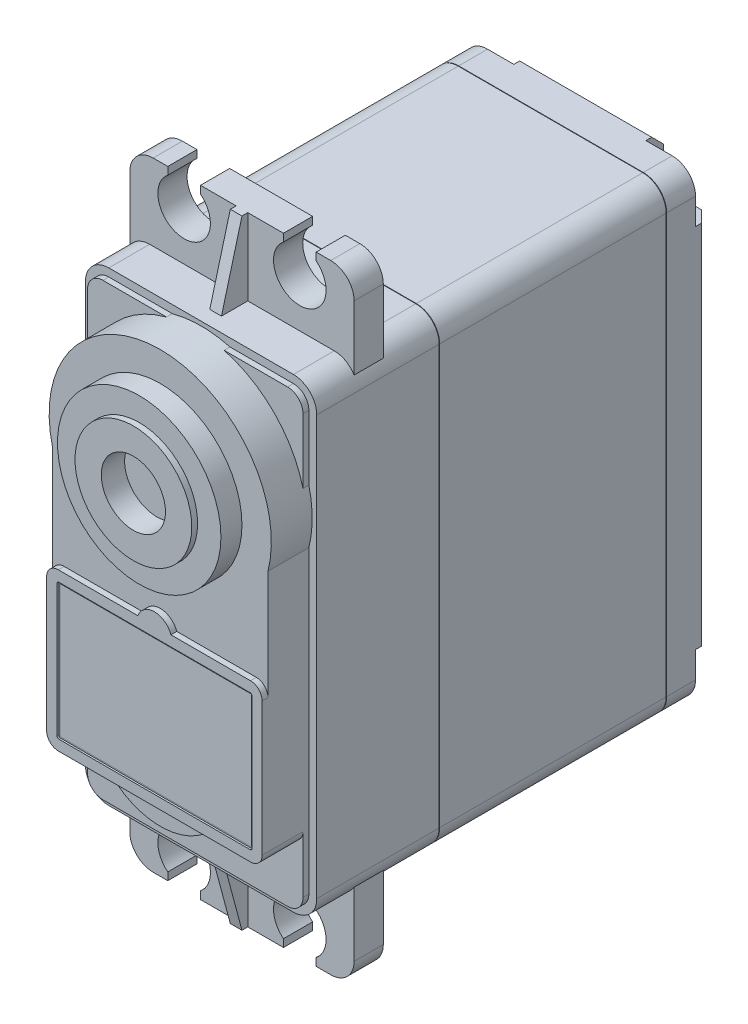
SolidWorks part; units mm, degrees
ref_plane "Piano frontale" through (0, 0, 0) normal (0, 0, 1) x (1, 0, 0)
ref_plane "Piano superiore" through (0, 0, 0) normal (0, 1, 0) x (1, 0, 0)
ref_plane "Piano destro" through (0, 0, 0) normal (1, 0, 0) x (0, 0, -1)
sketch "RIFERIMENTO" plane through (0, 0, 0) normal (0, 0, 1) x (1, 0, 0)
  line L0 (27.4785, 59.5052) -> (56.14, 59.5052) construction
  line L1 (31.8933, 83.5052) -> (51.7033, 83.5052) construction
  line L2 (31.8933, 35.5052) -> (51.7033, 35.5052) construction
  line L3 (41.7983, 33.0902) -> (41.7983, 85.9202) construction
  line L4 (46.7513, 33.0902) -> (46.7513, 85.9202) construction
  line L5 (36.8453, 33.0902) -> (36.8453, 85.9202) construction
  line L6 (35.4453, 33.0902) -> (35.4453, 33.7438)
  line L7 (38.2453, 33.0902) -> (38.2453, 33.7438)
  line L8 (45.3513, 33.0902) -> (45.3513, 33.7438)
  line L9 (48.1513, 33.0902) -> (48.1513, 33.7438)
  line L10 (38.2453, 33.0902) -> (45.3513, 33.0902)
  line L11 (35.4453, 85.9202) -> (35.4453, 85.2666)
  line L12 (38.2453, 85.9202) -> (38.2453, 85.2666)
  line L13 (48.1513, 85.9202) -> (48.1513, 85.2666)
  line L14 (45.3513, 85.9202) -> (45.3513, 85.2666)
  line L15 (35.4453, 85.9202) -> (34.1933, 85.9202)
  line L16 (32.1933, 83.9202) -> (32.1933, 78.4238)
  line L17 (45.3513, 85.9202) -> (38.2453, 85.9202)
  line L18 (28.408, 69.5052) -> (54.9221, 69.5052) construction
  line L19 (33.9696, 46.7742) -> (33.9696, 57.4156)
  line L20 (49.6489, 46.7742) -> (49.6489, 57.4156)
  line L21 (33.9696, 57.4156) -> (49.6489, 57.4156)
  line L22 (33.9696, 46.7742) -> (49.6489, 46.7742)
  line L23 (51.4033, 78.4238) -> (51.4033, 83.9202)
  line L24 (49.4033, 85.9202) -> (48.1513, 85.9202)
  line L25 (35.4453, 33.0902) -> (34.1933, 33.0902)
  line L26 (32.1933, 35.0902) -> (32.1933, 40.4366)
  line L27 (51.4033, 40.4366) -> (51.4033, 35.0902)
  line L28 (49.4033, 33.0902) -> (48.1513, 33.0902)
  line L29 (32.5696, 46.3742) -> (32.5696, 57.8156)
  line L30 (33.5696, 58.8156) -> (40.384, 58.8156)
  line L31 (33.5696, 45.3742) -> (50.0489, 45.3742)
  line L32 (42.3983, 69.2052) -> (42.6983, 69.2052)
  line L33 (42.8483, 69.3552) -> (42.8483, 69.6552)
  line L34 (42.6983, 69.8052) -> (42.3983, 69.8052)
  line L35 (42.0983, 70.1052) -> (42.0983, 70.4052)
  line L36 (41.9483, 70.5552) -> (41.6483, 70.5552)
  line L37 (41.4983, 70.4052) -> (41.4983, 70.1052)
  line L38 (41.1983, 69.8052) -> (40.8983, 69.8052)
  line L39 (40.7483, 69.6552) -> (40.7483, 69.3552)
  line L40 (40.8983, 69.2052) -> (41.1983, 69.2052)
  line L41 (41.4983, 68.9052) -> (41.4983, 68.6052)
  line L42 (41.6483, 68.4552) -> (41.9483, 68.4552)
  line L43 (42.0983, 68.6052) -> (42.0983, 68.9052)
  line L44 (31.8933, 77.3702) -> (31.8933, 41.4902)
  line L45 (33.8933, 39.4902) -> (49.7033, 39.4902)
  line L46 (51.7033, 41.4902) -> (51.7033, 77.3702)
  line L47 (49.7033, 79.3702) -> (33.8933, 79.3702)
  line L48 (32.5696, 77.3702) -> (32.5696, 41.4902)
  line L49 (33.8933, 40.1665) -> (49.7033, 40.1665)
  line L50 (51.027, 41.4902) -> (51.027, 77.3702)
  line L51 (49.7033, 78.6939) -> (33.8933, 78.6939)
  line L52 (51.027, 46.3742) -> (51.027, 57.8156)
  line L53 (42.2983, 33.0902) -> (42.2983, 39.4902)
  line L54 (41.2983, 33.0902) -> (41.2983, 39.4902)
  line L55 (42.2983, 81.4885) -> (42.2983, 85.9202)
  line L56 (41.2983, 81.4996) -> (41.2983, 85.9202)
  line L57 (70.4217, 57.5059) -> (70.4217, 81.4996)
  line L58 (70.4217, 81.4996) -> (72.4217, 81.4996)
  line L59 (72.4217, 81.4996) -> (72.4217, 57.5059)
  line L60 (72.4217, 57.5059) -> (70.4217, 57.5059)
  line L61 (76.9317, 45.3742) -> (76.9317, 58.8156)
  line L62 (76.9317, 58.8156) -> (77.4317, 58.8156)
  line L63 (80.9317, 39.4902) -> (80.9317, 79.3702)
  line L64 (113.8717, 39.4902) -> (80.9317, 39.4902)
  line L65 (91.4317, 39.4902) -> (91.4317, 79.3702)
  line L66 (80.9317, 79.3702) -> (113.8717, 79.3702)
  line L67 (114.8717, 78.3702) -> (114.8717, 40.4902)
  line L68 (86.9317, 39.4902) -> (86.9317, 33.0902)
  line L69 (86.9317, 33.0902) -> (84.4317, 33.0902)
  line L70 (84.4317, 33.0902) -> (84.4317, 39.4902)
  line L71 (84.4317, 33.0902) -> (83.9317, 33.0902)
  line L72 (83.9317, 33.0902) -> (82.2168, 39.4902)
  line L73 (86.9317, 79.3702) -> (86.9317, 85.7702)
  line L74 (86.9317, 85.7702) -> (84.4317, 85.7702)
  line L75 (84.4317, 85.7702) -> (84.4317, 79.3702)
  line L76 (84.4317, 85.7702) -> (83.9317, 85.7702)
  line L77 (83.9317, 85.7702) -> (82.2168, 79.3702)
  line L78 (76.9317, 45.3742) -> (80.4317, 45.3742)
  line L79 (80.9317, 78.8702) -> (80.4317, 78.8702)
  line L80 (77.4317, 79.0202) -> (77.4317, 58.8156)
  line L81 (76.9317, 58.8156) -> (76.9317, 59.8156)
  line L82 (76.9317, 59.8156) -> (77.4317, 59.8156)
  line L83 (77.4317, 43.6525) -> (80.4317, 43.6525)
  line L84 (80.9317, 39.9902) -> (80.4317, 39.9902)
  line L85 (80.4317, 39.9902) -> (80.4317, 67.1884)
  line L86 (77.4317, 45.3742) -> (77.4317, 43.6525)
  line L87 (80.9317, 79.0202) -> (77.4317, 79.0202)
  line L88 (77.4317, 67.1884) -> (80.4317, 67.1884)
  line L89 (80.4317, 71.8219) -> (80.4317, 78.8702)
  line L90 (69.9217, 65.8051) -> (69.9217, 73.2003)
  line L91 (70.4217, 73.2003) -> (69.9217, 73.2003)
  line L92 (70.4217, 65.8051) -> (69.9217, 65.8051)
  line L93 (110.8717, 79.3702) -> (110.8717, 39.4902)
  line L94 (114.8717, 43.7402) -> (113.3717, 43.7402)
  line L95 (113.3717, 43.7402) -> (113.3717, 39.4902)
  line L96 (113.8717, 39.4902) -> (114.8717, 40.4902)
  line L97 (113.8717, 79.3702) -> (114.8717, 78.3702)
  line L98 (114.8717, 75.1202) -> (113.3717, 75.1202)
  line L99 (113.3717, 75.1202) -> (113.3717, 79.3702)
  line L100 (113.8717, 75.1202) -> (113.8717, 43.7402)
  line L101 (72.4217, 74.0027) -> (74.4217, 74.0027)
  line L102 (74.4217, 74.0027) -> (74.4217, 65.0027)
  line L103 (74.4217, 65.0027) -> (72.4217, 65.0027)
  line L104 (67.8152, 69.5052) -> (83.0318, 69.5052) construction
  line L105 (75.6317, 76.5052) -> (75.6317, 62.5052)
  line L106 (75.6317, 76.5052) -> (77.4317, 76.5052)
  line L107 (75.6317, 62.5052) -> (77.4317, 62.5052)
  line L108 (75.6317, 74.5052) -> (75.1317, 74.5052)
  line L109 (75.1317, 74.5052) -> (75.1317, 64.5052)
  line L110 (75.1317, 64.5052) -> (75.6317, 64.5052)
  line L111 (43.2125, 58.8156) -> (50.0489, 58.8156)
  arc A0 (48.1513, 33.7438) -> (45.3513, 33.7438) centre (46.7513, 35.5052) ccw
  arc A1 (38.2453, 33.7438) -> (35.4453, 33.7438) centre (36.8453, 35.5052) ccw
  arc A2 (35.4453, 85.2666) -> (38.2453, 85.2666) centre (36.8453, 83.5052) ccw
  arc A3 (45.3513, 85.2666) -> (48.1513, 85.2666) centre (46.7513, 83.5052) ccw
  circle A4 centre (41.6651, 69.5052) radius 12
  circle A5 centre (50.2983, 69.5052) radius 0.6
  circle A6 centre (49.7985, 72.3768) radius 0.6
  circle A7 centre (49.7985, 66.6335) radius 0.6
  circle A8 centre (33.2983, 69.5052) radius 0.6
  circle A9 centre (33.798, 72.3768) radius 0.6
  circle A10 centre (33.798, 66.6335) radius 0.6
  circle A11 centre (41.7983, 76.3052) radius 0.6
  circle A12 centre (41.7983, 79.5052) radius 0.6
  circle A13 centre (44.1459, 75.8871) radius 0.6
  circle A14 centre (45.2506, 78.8903) radius 0.6
  circle A15 centre (39.4507, 75.8871) radius 0.6
  circle A16 centre (38.3459, 78.8903) radius 0.6
  circle A17 centre (41.7983, 62.7052) radius 0.6
  circle A18 centre (41.7983, 59.5052) radius 0.6
  circle A19 centre (44.1459, 63.1233) radius 0.6
  circle A20 centre (45.2506, 60.12) radius 0.6
  circle A21 centre (39.4507, 63.1233) radius 0.6
  circle A22 centre (38.3459, 60.12) radius 0.6
  circle A23 centre (41.7983, 69.5052) radius 2.5
  circle A24 centre (41.7983, 69.5052) radius 2.9
  circle A25 centre (41.7983, 69.5052) radius 3.7
  arc A26 (32.5696, 46.3742) -> (33.5696, 45.3742) centre (33.5696, 46.3742) ccw
  arc A27 (33.5696, 58.8156) -> (32.5696, 57.8156) centre (33.5696, 57.8156) ccw
  arc A28 (37.6025, 45.3742) -> (46.0159, 45.3742) centre (41.8092, 49.6525) ccw
  arc A29 (50.027, 45.3742) -> (51.027, 46.3742) centre (50.027, 46.3742) ccw
  arc A30 (51.027, 57.8156) -> (50.027, 58.8156) centre (50.027, 57.8156) ccw
  arc A31 (43.2125, 58.8156) -> (40.384, 58.8156) centre (41.7983, 58.3156) ccw
  arc A32 (34.1933, 85.9202) -> (32.1933, 83.9202) centre (34.1933, 83.9202) ccw
  arc A33 (51.4033, 83.9202) -> (49.4033, 85.9202) centre (49.4033, 83.9202) ccw
  arc A34 (32.1933, 35.0902) -> (34.1933, 33.0902) centre (34.1933, 35.0902) ccw
  arc A35 (49.4033, 33.0902) -> (51.4033, 35.0902) centre (49.4033, 35.0902) ccw
  arc A36 (42.3983, 69.2052) -> (42.0983, 68.9052) centre (42.3983, 68.9052) ccw
  arc A37 (42.6983, 69.2052) -> (42.8483, 69.3552) centre (42.6983, 69.3552) ccw
  arc A38 (42.8483, 69.6552) -> (42.6983, 69.8052) centre (42.6983, 69.6552) ccw
  arc A39 (42.0983, 70.1052) -> (42.3983, 69.8052) centre (42.3983, 70.1052) ccw
  arc A40 (42.0983, 70.4052) -> (41.9483, 70.5552) centre (41.9483, 70.4052) ccw
  arc A41 (41.6483, 70.5552) -> (41.4983, 70.4052) centre (41.6483, 70.4052) ccw
  arc A42 (41.1983, 69.8052) -> (41.4983, 70.1052) centre (41.1983, 70.1052) ccw
  arc A43 (40.8983, 69.8052) -> (40.7483, 69.6552) centre (40.8983, 69.6552) ccw
  arc A44 (40.7483, 69.3552) -> (40.8983, 69.2052) centre (40.8983, 69.3552) ccw
  arc A45 (41.4983, 68.9052) -> (41.1983, 69.2052) centre (41.1983, 68.9052) ccw
  arc A46 (41.4983, 68.6052) -> (41.6483, 68.4552) centre (41.6483, 68.6052) ccw
  arc A47 (41.9483, 68.4552) -> (42.0983, 68.6052) centre (41.9483, 68.6052) ccw
  arc A48 (31.8933, 41.4902) -> (33.8933, 39.4902) centre (33.8933, 41.4902) ccw
  arc A49 (49.7033, 39.4902) -> (51.7033, 41.4902) centre (49.7033, 41.4902) ccw
  arc A50 (51.7033, 77.3702) -> (49.7033, 79.3702) centre (49.7033, 77.3702) ccw
  arc A51 (33.8933, 79.3702) -> (31.8933, 77.3702) centre (33.8933, 77.3702) ccw
  arc A52 (32.5696, 41.4902) -> (33.8933, 40.1665) centre (33.8933, 41.4902) ccw
  arc A53 (49.7033, 40.1665) -> (51.027, 41.4902) centre (49.7033, 41.4902) ccw
  arc A54 (51.027, 77.3702) -> (49.7033, 78.6939) centre (49.7033, 77.3702) ccw
  arc A55 (33.8933, 78.6939) -> (32.5696, 77.3702) centre (33.8933, 77.3702) ccw
sketch "Schizzo2" plane through (0, 0, 0) normal (0, 0, 1) x (1, 0, 0)
  line L0 (49.7033, 79.3702) -> (33.8933, 79.3702) construction
  line L1 (51.7033, 41.4902) -> (51.7033, 77.3702) construction
  line L2 (33.8933, 39.4902) -> (49.7033, 39.4902) construction
  line L3 (31.8933, 77.3702) -> (31.8933, 41.4902) construction
  line L4 (49.7033, 79.3702) -> (33.8933, 79.3702)
  line L5 (51.7033, 41.4902) -> (51.7033, 77.3702)
  line L6 (33.8933, 39.4902) -> (49.7033, 39.4902)
  line L7 (31.8933, 77.3702) -> (31.8933, 41.4902)
  arc A0 (33.8933, 79.3702) -> (31.8933, 77.3702) centre (33.8933, 77.3702) ccw construction
  arc A1 (51.7033, 77.3702) -> (49.7033, 79.3702) centre (49.7033, 77.3702) ccw construction
  arc A2 (49.7033, 39.4902) -> (51.7033, 41.4902) centre (49.7033, 41.4902) ccw construction
  arc A3 (31.8933, 41.4902) -> (33.8933, 39.4902) centre (33.8933, 41.4902) ccw construction
  arc A4 (33.8933, 79.3702) -> (31.8933, 77.3702) centre (33.8933, 77.3702) ccw
  arc A5 (51.7033, 77.3702) -> (49.7033, 79.3702) centre (49.7033, 77.3702) ccw
  arc A6 (49.7033, 39.4902) -> (51.7033, 41.4902) centre (49.7033, 41.4902) ccw
  arc A7 (31.8933, 41.4902) -> (33.8933, 39.4902) centre (33.8933, 41.4902) ccw
extrude "Estrusione-Estrusione1" add sketch "Schizzo2" along normal blind 4
sketch "Schizzo3" plane through (0, 0, 4) normal (0, 0, 1) x (1, 0, 0)
  line L4 (31.8933, 77.3702) -> (31.8933, 41.4902)
  line L5 (33.8933, 39.4902) -> (49.7033, 39.4902)
  line L6 (51.7033, 41.4902) -> (51.7033, 77.3702)
  line L7 (49.7033, 79.3702) -> (33.8933, 79.3702)
  line L8 (31.8933, 77.3702) -> (31.8933, 41.4902)
  line L9 (33.8933, 39.4902) -> (49.7033, 39.4902)
  line L10 (51.7033, 41.4902) -> (51.7033, 77.3702)
  line L11 (49.7033, 79.3702) -> (33.8933, 79.3702)
  arc A4 (33.8933, 79.3702) -> (31.8933, 77.3702) centre (33.8933, 77.3702) ccw
  arc A5 (31.8933, 41.4902) -> (33.8933, 39.4902) centre (33.8933, 41.4902) ccw
  arc A6 (49.7033, 39.4902) -> (51.7033, 41.4902) centre (49.7033, 41.4902) ccw
  arc A7 (51.7033, 77.3702) -> (49.7033, 79.3702) centre (49.7033, 77.3702) ccw
  arc A8 (33.8933, 79.3702) -> (31.8933, 77.3702) centre (33.8933, 77.3702) ccw
  arc A9 (31.8933, 41.4902) -> (33.8933, 39.4902) centre (33.8933, 41.4902) ccw
  arc A10 (49.7033, 39.4902) -> (51.7033, 41.4902) centre (49.7033, 41.4902) ccw
  arc A11 (51.7033, 77.3702) -> (49.7033, 79.3702) centre (49.7033, 77.3702) ccw
  dimension "D1" = 0
extrude "Estrusione-Estrusione2" add sketch "Schizzo3" along normal blind 19.44 separate body
sketch "Schizzo4" plane through (0, 0, 23.44) normal (0, 0, 1) x (1, 0, 0)
  line L4 (31.8933, 77.3702) -> (31.8933, 41.4902)
  line L5 (33.8933, 39.4902) -> (49.7033, 39.4902)
  line L6 (51.7033, 41.4902) -> (51.7033, 77.3702)
  line L7 (49.7033, 79.3702) -> (33.8933, 79.3702)
  line L8 (31.8933, 77.3702) -> (31.8933, 41.4902)
  line L9 (33.8933, 39.4902) -> (49.7033, 39.4902)
  line L10 (51.7033, 41.4902) -> (51.7033, 77.3702)
  line L11 (49.7033, 79.3702) -> (33.8933, 79.3702)
  arc A4 (33.8933, 79.3702) -> (31.8933, 77.3702) centre (33.8933, 77.3702) ccw
  arc A5 (31.8933, 41.4902) -> (33.8933, 39.4902) centre (33.8933, 41.4902) ccw
  arc A6 (49.7033, 39.4902) -> (51.7033, 41.4902) centre (49.7033, 41.4902) ccw
  arc A7 (51.7033, 77.3702) -> (49.7033, 79.3702) centre (49.7033, 77.3702) ccw
  arc A8 (33.8933, 79.3702) -> (31.8933, 77.3702) centre (33.8933, 77.3702) ccw
  arc A9 (31.8933, 41.4902) -> (33.8933, 39.4902) centre (33.8933, 41.4902) ccw
  arc A10 (49.7033, 39.4902) -> (51.7033, 41.4902) centre (49.7033, 41.4902) ccw
  arc A11 (51.7033, 77.3702) -> (49.7033, 79.3702) centre (49.7033, 77.3702) ccw
  dimension "D1" = 0
extrude "Estrusione-Estrusione3" add sketch "Schizzo4" along normal blind 10.5 separate body
ref_plane "Piano1" through (0, 0, 27.94) normal (0, 0, 1) x (1, 0, 0)
sketch "Schizzo5" plane through (0, 0, 27.94) normal (0, 0, 1) x (1, 0, 0)
  line L0 (32.1933, 83.9202) -> (32.1933, 78.4238) construction
  line L1 (35.4453, 85.9202) -> (34.1933, 85.9202) construction
  line L2 (45.3513, 85.9202) -> (38.2453, 85.9202) construction
  line L3 (49.4033, 85.9202) -> (48.1513, 85.9202) construction
  line L4 (51.4033, 78.4238) -> (51.4033, 83.9202) construction
  line L5 (35.4453, 85.9202) -> (35.4453, 85.2666) construction
  line L6 (38.2453, 85.9202) -> (38.2453, 85.2666) construction
  line L7 (45.3513, 85.9202) -> (45.3513, 85.2666) construction
  line L8 (48.1513, 85.9202) -> (48.1513, 85.2666) construction
  line L9 (49.7033, 79.3702) -> (33.8933, 79.3702) construction
  line L10 (32.1933, 83.9202) -> (32.1933, 78.4238)
  line L11 (35.4453, 85.9202) -> (34.1933, 85.9202)
  line L12 (45.3513, 85.9202) -> (38.2453, 85.9202)
  line L13 (49.4033, 85.9202) -> (48.1513, 85.9202)
  line L14 (51.4033, 78.4238) -> (51.4033, 83.9202)
  line L15 (35.4453, 85.9202) -> (35.4453, 85.2666)
  line L16 (38.2453, 85.9202) -> (38.2453, 85.2666)
  line L17 (45.3513, 85.9202) -> (45.3513, 85.2666)
  line L18 (48.1513, 85.9202) -> (48.1513, 85.2666)
  line L19 (49.7033, 79.3702) -> (33.8933, 79.3702)
  arc A0 (34.1933, 85.9202) -> (32.1933, 83.9202) centre (34.1933, 83.9202) ccw construction
  arc A1 (51.4033, 83.9202) -> (49.4033, 85.9202) centre (49.4033, 83.9202) ccw construction
  arc A2 (45.3513, 85.2666) -> (48.1513, 85.2666) centre (46.7513, 83.5052) ccw construction
  arc A3 (35.4453, 85.2666) -> (38.2453, 85.2666) centre (36.8453, 83.5052) ccw construction
  arc A4 (33.8933, 79.3702) -> (31.8933, 77.3702) centre (33.8933, 77.3702) ccw construction
  arc A5 (51.7033, 77.3702) -> (49.7033, 79.3702) centre (49.7033, 77.3702) ccw construction
  arc A6 (34.1933, 85.9202) -> (32.1933, 83.9202) centre (34.1933, 83.9202) ccw
  arc A7 (51.4033, 83.9202) -> (49.4033, 85.9202) centre (49.4033, 83.9202) ccw
  arc A8 (45.3513, 85.2666) -> (48.1513, 85.2666) centre (46.7513, 83.5052) ccw
  arc A9 (35.4453, 85.2666) -> (38.2453, 85.2666) centre (36.8453, 83.5052) ccw
  arc A10 (33.8933, 79.3702) -> (32.1933, 78.4238) centre (33.8933, 77.3702) ccw
  arc A11 (51.4033, 78.4238) -> (49.7033, 79.3702) centre (49.7033, 77.3702) ccw
extrude "Estrusione-Estrusione4" add sketch "Schizzo5" along normal blind 2.5 separate body
ref_plane "Piano di Mezzeria TRASVERSALE" through (0, 59.4302, 0) normal (0, 1, 0) x (-1, 0, 0)
ref_plane "Piano di Mezzeria LONGITUDINALE" through (41.7983, 0, 0) normal (1, 0, 0) x (0, 0, -1)
sketch "Schizzo7" plane through (41.7983, 0, 0) normal (1, 0, 0) x (0, 0, -1)
  line L0 (-30.44, 85.9202) -> (-30.94, 85.9202)
  line L1 (-30.94, 85.9202) -> (-32.6951, 79.3702)
  line L2 (-33.94, 79.3702) -> (-23.44, 79.3702) construction
  line L3 (-32.6951, 79.3702) -> (-30.44, 79.3702)
  line L4 (-30.44, 79.3702) -> (-30.44, 85.9202)
  dimension "D1" = 15
  dimension "D2" = 0.5
extrude "Estrusione-Estrusione5" add sketch "Schizzo7" along normal mid plane 1 separate body
mirror "Specchia1" about plane through (0, 59.4302, 0) normal (0, 1, 0)
combine bodies "Abbina1" operation type add bodies to combine 107 106 103 104 105
sketch "Schizzo8" plane through (51.7033, 0, 0) normal (1, 0, 0) x (0, 0, -1)
  line L2 (-4, 75.1202) -> (0, 75.1202)
  line L3 (-1.5, 75.1202) -> (1.0182, 75.1202)
  line L4 (-1.5, 80.472) -> (1.0182, 80.472)
  line L5 (-1.5, 41.4902) -> (-1.5, 77.3702)
  line L6 (-1.5, 75.1202) -> (-1.5, 80.472)
  line L7 (1.0182, 80.472) -> (1.0182, 75.1202)
  line L8 (-6.4413, 59.4302) -> (5.8059, 59.4302) construction
  line L9 (1.0182, 38.3884) -> (1.0182, 43.7402)
  line L10 (-1.5, 43.7402) -> (-1.5, 38.3884)
  line L11 (-1.5, 38.3884) -> (1.0182, 38.3884)
  line L12 (-1.5, 43.7402) -> (1.0182, 43.7402)
  dimension "D1" = 4.25
  dimension "D2" = 1.5
extrude "Taglio-Estrusione1" cut sketch "Schizzo8" against normal blind 4.25
mirror "Specchia2" about plane through (41.7983, 0, 0) normal (1, 0, 0) of "Taglio-Estrusione1"
fillet "Raccordo1" radius 2.5 4 edges at (47.4533, 43.7402, 0.75) (36.1433, 43.7402, 0.75) (36.1433, 75.1202, 0.75) (47.4533, 75.1202, 0.75)
chamfer "Smusso1" distance 1 angle 45 4 edges at (41.7983, 79.3702, 0) (31.8933, 59.4302, 0) (51.7033, 59.4302, 0) (41.7983, 39.4902, 0)
sketch "Schizzo9" plane through (0, 0, 33.94) normal (0, 0, 1) x (1, 0, 0)
  line L0 (32.5696, 77.3702) -> (32.5696, 41.4902) construction
  line L1 (49.7033, 78.6939) -> (33.8933, 78.6939) construction
  line L2 (51.027, 41.4902) -> (51.027, 77.3702) construction
  line L3 (33.8933, 40.1665) -> (49.7033, 40.1665) construction
  line L4 (32.5696, 77.3702) -> (32.5696, 41.4902)
  line L5 (49.7033, 78.6939) -> (33.8933, 78.6939)
  line L6 (51.027, 41.4902) -> (51.027, 77.3702)
  line L7 (33.8933, 40.1665) -> (49.7033, 40.1665)
  arc A0 (33.8933, 78.6939) -> (32.5696, 77.3702) centre (33.8933, 77.3702) ccw construction
  arc A1 (51.027, 77.3702) -> (49.7033, 78.6939) centre (49.7033, 77.3702) ccw construction
  arc A2 (49.7033, 40.1665) -> (51.027, 41.4902) centre (49.7033, 41.4902) ccw construction
  arc A3 (32.5696, 41.4902) -> (33.8933, 40.1665) centre (33.8933, 41.4902) ccw construction
  arc A4 (33.8933, 78.6939) -> (32.5696, 77.3702) centre (33.8933, 77.3702) ccw
  arc A5 (51.027, 77.3702) -> (49.7033, 78.6939) centre (49.7033, 77.3702) ccw
  arc A6 (49.7033, 40.1665) -> (51.027, 41.4902) centre (49.7033, 41.4902) ccw
  arc A7 (32.5696, 41.4902) -> (33.8933, 40.1665) centre (33.8933, 41.4902) ccw
extrude "Estrusione-Estrusione6" add sketch "Schizzo9" along normal blind 0.5
sketch "Schizzo10" plane through (0, 0, 34.44) normal (0, 0, 1) x (1, 0, 0)
  line L0 (33.5696, 45.3742) -> (50.0489, 45.3742) construction
  line L2 (33.5696, 45.3742) -> (37.6025, 45.3742)
  line L7 (46.0159, 45.3742) -> (50.0489, 45.3742)
  line L8 (32.5696, 67.1886) -> (32.5696, 46.3742)
  line L9 (51.027, 67.1886) -> (51.027, 46.3742)
  arc A0 (37.6025, 45.3742) -> (46.0159, 45.3742) centre (41.8092, 49.6525) ccw construction
  arc A1 (32.5696, 46.3742) -> (33.5696, 45.3742) centre (33.5696, 46.3742) ccw construction
  arc A2 (50.027, 45.3742) -> (51.027, 46.3742) centre (50.027, 46.3742) ccw construction
  arc A5 (37.6025, 45.3742) -> (46.0159, 45.3742) centre (41.8092, 49.6525) ccw
  arc A6 (32.5696, 46.3742) -> (33.5696, 45.3742) centre (33.5696, 46.3742) ccw
  arc A7 (50.027, 45.3742) -> (51.027, 46.3742) centre (50.027, 46.3742) ccw
  arc A10 (39.328, 78.6939) -> (32.5696, 67.1886) centre (41.7983, 69.5052) ccw
  arc A11 (51.027, 67.1886) -> (44.2685, 78.6939) centre (41.7983, 69.5052) ccw
  arc A12 (44.2685, 78.6939) -> (39.328, 78.6939) centre (41.7983, 69.5052) ccw
  dimension "D1" = 9.515
extrude "Estrusione-Estrusione7" add sketch "Schizzo10" along normal blind 3 contours A12 M8 | A11 M6 | A10 M2 | L7 A7 A6 L2 A5 M6 M7 M8 M1 M2
sketch "Schizzo11" plane through (0, 0, 37.44) normal (0, 0, 1) x (1, 0, 0)
  line L0 (33.5696, 45.3742) -> (50.0489, 45.3742) construction
  line L1 (32.5696, 46.3742) -> (32.5696, 57.8156) construction
  line L2 (51.027, 41.4902) -> (51.027, 77.3702) construction
  line L3 (33.5696, 58.8156) -> (40.384, 58.8156) construction
  line L4 (43.2125, 58.8156) -> (50.0489, 58.8156) construction
  line L5 (33.5696, 45.3742) -> (50.0489, 45.3742)
  line L6 (32.5696, 46.3742) -> (32.5696, 57.8156)
  line L7 (51.027, 46.3742) -> (51.027, 57.8156)
  line L8 (33.5696, 58.8156) -> (40.384, 58.8156)
  line L9 (43.2125, 58.8156) -> (50.0489, 58.8156)
  arc A0 (32.5696, 46.3742) -> (33.5696, 45.3742) centre (33.5696, 46.3742) ccw construction
  arc A1 (50.027, 45.3742) -> (51.027, 46.3742) centre (50.027, 46.3742) ccw construction
  arc A2 (33.5696, 58.8156) -> (32.5696, 57.8156) centre (33.5696, 57.8156) ccw construction
  arc A3 (51.027, 57.8156) -> (50.027, 58.8156) centre (50.027, 57.8156) ccw construction
  arc A4 (43.2125, 58.8156) -> (40.384, 58.8156) centre (41.7983, 58.3156) ccw construction
  arc A5 (32.5696, 46.3742) -> (33.5696, 45.3742) centre (33.5696, 46.3742) ccw
  arc A6 (50.027, 45.3742) -> (51.027, 46.3742) centre (50.027, 46.3742) ccw
  arc A7 (33.5696, 58.8156) -> (32.5696, 57.8156) centre (33.5696, 57.8156) ccw
  arc A8 (51.027, 57.8156) -> (50.027, 58.8156) centre (50.027, 57.8156) ccw
  arc A9 (43.2125, 58.8156) -> (40.384, 58.8156) centre (41.7983, 58.3156) ccw
extrude "Estrusione-Estrusione8" add sketch "Schizzo11" along normal blind 0.5 contours L9 A9 L8 A7 L5 A8 M9 M10 M11 M1 M2 M3
sketch "Schizzo12" plane through (0, 0, 33.94) normal (0, 0, 1) x (1, 0, 0)
  circle A0 centre (41.7983, 69.5052) radius 9.515
extrude "Estrusione-Estrusione9" add sketch "Schizzo12" along normal blind 0.5
sketch "Schizzo13" plane through (0, 0, 37.94) normal (0, 0, 1) x (1, 0, 0)
  line L13 (50.1489, 46.2742) -> (50.1489, 57.9156)
  line L14 (33.4696, 46.2742) -> (50.1489, 46.2742)
  line L15 (33.4696, 57.9156) -> (33.4696, 46.2742)
  line L16 (50.1489, 57.9156) -> (33.4696, 57.9156)
  line L17 (50.1489, 46.4242) -> (50.1489, 57.7656)
  line L18 (33.6196, 46.2742) -> (49.9989, 46.2742)
  line L19 (33.4696, 57.7656) -> (33.4696, 46.4242)
  line L20 (49.9989, 57.9156) -> (33.6196, 57.9156)
  arc A5 (33.6196, 46.2742) -> (33.4696, 46.4242) centre (33.6196, 46.4242) cw
  arc A6 (50.1489, 46.4242) -> (49.9989, 46.2742) centre (49.9989, 46.4242) cw
  arc A7 (50.1489, 57.7656) -> (49.9989, 57.9156) centre (49.9989, 57.7656) ccw
  arc A8 (33.4696, 57.7656) -> (33.6196, 57.9156) centre (33.6196, 57.7656) cw
  dimension "D2" = 0.15
  dimension "D1" = 0.5
extrude "Taglio-Estrusione2" cut sketch "Schizzo13" against normal blind 0.15
sketch "Schizzo14" plane through (0, 0, 37.44) normal (0, 0, 1) x (1, 0, 0)
  circle A0 centre (41.7983, 69.5052) radius 7
  dimension "D1" = 14
extrude "Estrusione-Estrusione10" add sketch "Schizzo14" along normal blind 1.8
sketch "Schizzo15" plane through (0, 0, 39.24) normal (0, 0, 1) x (1, 0, 0)
  circle A0 centre (41.7983, 69.5052) radius 5
  dimension "D1" = 10
extrude "Estrusione-Estrusione11" add sketch "Schizzo15" along normal blind 0.5
sketch "Schizzo16" plane through (0, 0, 39.74) normal (0, 0, 1) x (1, 0, 0)
  circle A0 centre (41.7983, 69.5052) radius 2.75
  dimension "D1" = 5.5
extrude "Taglio-Estrusione3" cut sketch "Schizzo16" against normal blind 2
sketch "Schizzo17" plane through (0, 0, 37.79) normal (0, 0, 1) x (1, 0, 0)
  line L8 (33.6196, 46.4242) -> (49.9989, 46.4242)
  line L9 (49.9989, 46.4242) -> (49.9989, 57.7656)
  line L10 (49.9989, 57.7656) -> (33.6196, 57.7656)
  line L11 (33.6196, 57.7656) -> (33.6196, 46.4242)
  line L12 (33.6196, 46.4242) -> (49.9989, 46.4242)
  line L13 (49.9989, 46.4242) -> (49.9989, 57.7656)
  line L14 (49.9989, 57.7656) -> (33.6196, 57.7656)
  line L15 (33.6196, 57.7656) -> (33.6196, 46.4242)
  dimension "D1" = 0.15
extrude "Estrusione-Estrusione12" add sketch "Schizzo17" along normal blind 0.05 separate body
chamfer "Smusso2" distance 0.025 angle 60 8 edges at (51.7033, 59.4302, 4) (51.1175, 78.7844, 4) (51.1175, 40.076, 4) (41.7983, 79.3702, 4) (41.7983, 39.4902, 4) (32.479, 78.7844, 4) (32.479, 40.076, 4) (31.8933, 59.4302, 4)
chamfer "Smusso3" distance 0.025 angle 30 8 edges at (51.7033, 59.4302, 4) (51.1175, 78.7844, 4) (51.1175, 40.076, 4) (41.7983, 79.3702, 4) (41.7983, 39.4902, 4) (32.479, 78.7844, 4) (32.479, 40.076, 4) (31.8933, 59.4302, 4)
chamfer "Smusso4" distance 0.025 angle 30 8 edges at (51.7033, 59.4302, 23.44) (51.1175, 78.7844, 23.44) (51.1175, 40.076, 23.44) (41.7983, 79.3702, 23.44) (41.7983, 39.4902, 23.44) (32.479, 78.7844, 23.44) (32.479, 40.076, 23.44) (31.8933, 59.4302, 23.44)
chamfer "Smusso5" distance 0.025 angle 60 8 edges at (51.7033, 59.4302, 23.44) (51.1175, 78.7844, 23.44) (51.1175, 40.076, 23.44) (41.7983, 79.3702, 23.44) (41.7983, 39.4902, 23.44) (32.479, 78.7844, 23.44) (32.479, 40.076, 23.44) (31.8933, 59.4302, 23.44)
